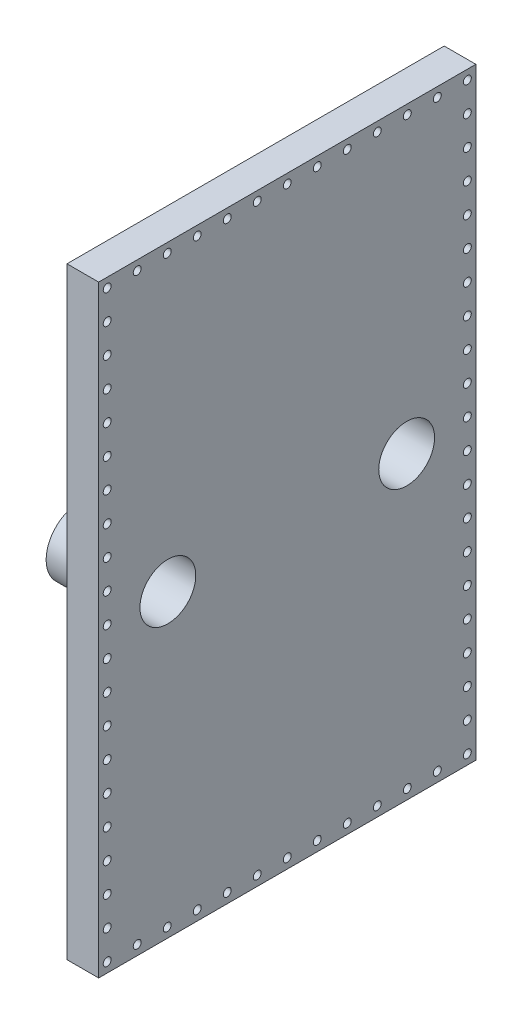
SolidWorks part; units mm, degrees
ref_plane "Alzado" through (0, 0, 0) normal (0, 0, 1) x (1, 0, 0)
ref_plane "Planta" through (0, 0, 0) normal (0, 1, 0) x (1, 0, 0)
ref_plane "Vista lateral" through (0, 0, 0) normal (1, 0, 0) x (0, 0, -1)
sketch "Croquis1" plane through (0, 0, 0) normal (0, 0, 1) x (1, 0, 0)
  line L0 (0, 0) -> (1191.5, 0)
  line L1 (1191.5, 0) -> (1191.5, 723)
  line L2 (0, 723) -> (1191.5, 723)
  line L3 (0, 0) -> (0, 723)
  line L6 (38, 38) -> (38, 685)
  line L11 (38, 38) -> (1153.5, 38)
  line L12 (1153.5, 38) -> (1153.5, 685)
  line L13 (38, 685) -> (1153.5, 685)
extrude "Saliente-Extruir1" add sketch "Croquis1" along normal blind 452.5
sketch "Croquis7" plane through (0, 0, 0) normal (-1, 0, 0) x (0, 0, 1)
  circle A0 centre (83, 360) radius 40
  circle A1 centre (369.5, 360) radius 40
  dimension "D1" = 83
  dimension "D5" = 80
  dimension "D6" = 80
  dimension "D2" = 360
  dimension "D3" = 83
  dimension "D4" = 360
extrude "Saliente-Extruir3" add sketch "Croquis7" along normal blind 68
sketch "Croquis8" plane through (-68, 0, 0) normal (-1, 0, 0) x (0, 0, 1)
  circle A0 centre (83, 360) radius 33.5
  circle A1 centre (369.5, 360) radius 33.5
  dimension "D1" = 67
  dimension "D2" = 67
extrude "Cortar-Extruir1" cut sketch "Croquis8" against normal blind 106
sketch "Croquis9" plane through (1191.5, 0, 0) normal (1, 0, 0) x (0, 0, -1)
  circle A0 centre (-264.5, 101.5) radius 19
  circle A1 centre (-182, 624.5) radius 14.35
  dimension "D5" = 38
  dimension "D6" = 28.7
  dimension "D1" = 188
  dimension "D2" = 101.5
  dimension "D3" = 82.5
  dimension "D4" = 98.5
extrude "Cortar-Extruir2" cut sketch "Croquis9" against normal blind 38
sketch "Croquis14" plane through (0, 0, 0) normal (-1, 0, 0) x (0, 0, 1)
  circle A0 centre (10.25, 711.75) radius 4.7625
  circle A1 centre (46.25, 711.75) radius 4.7625
  circle A2 centre (82.25, 711.75) radius 4.7625
  circle A3 centre (118.25, 711.75) radius 4.7625
  circle A4 centre (154.25, 711.75) radius 4.7625
  circle A5 centre (190.25, 711.75) radius 4.7625
  circle A6 centre (226.25, 711.75) radius 4.7625
  circle A7 centre (262.25, 711.75) radius 4.7625
  circle A8 centre (298.25, 711.75) radius 4.7625
  circle A9 centre (334.25, 711.75) radius 4.7625
  circle A10 centre (370.25, 711.75) radius 4.7625
  circle A11 centre (406.25, 711.75) radius 4.7625
  circle A12 centre (442.25, 711.75) radius 4.7625
  circle A13 centre (10.25, 676.75) radius 4.7625
  circle A14 centre (10.25, 641.75) radius 4.7625
  circle A15 centre (10.25, 606.75) radius 4.7625
  circle A16 centre (10.25, 571.75) radius 4.7625
  circle A17 centre (10.25, 536.75) radius 4.7625
  circle A18 centre (10.25, 501.75) radius 4.7625
  circle A19 centre (10.25, 466.75) radius 4.7625
  circle A20 centre (10.25, 431.75) radius 4.7625
  circle A21 centre (10.25, 396.75) radius 4.7625
  circle A22 centre (10.25, 361.75) radius 4.7625
  circle A23 centre (10.25, 326.75) radius 4.7625
  circle A24 centre (10.25, 291.75) radius 4.7625
  circle A25 centre (10.25, 256.75) radius 4.7625
  circle A26 centre (10.25, 221.75) radius 4.7625
  circle A27 centre (10.25, 186.75) radius 4.7625
  circle A28 centre (10.25, 151.75) radius 4.7625
  circle A29 centre (10.25, 116.75) radius 4.7625
  circle A30 centre (10.25, 81.75) radius 4.7625
  circle A31 centre (10.25, 46.75) radius 4.7625
  circle A32 centre (10.25, 11.75) radius 4.7625
  circle A33 centre (46.25, 11.75) radius 4.7625
  circle A34 centre (82.25, 11.75) radius 4.7625
  circle A35 centre (118.25, 11.75) radius 4.7625
  circle A36 centre (154.25, 11.75) radius 4.7625
  circle A37 centre (190.25, 11.75) radius 4.7625
  circle A38 centre (226.25, 11.75) radius 4.7625
  circle A39 centre (262.25, 11.75) radius 4.7625
  circle A40 centre (298.25, 11.75) radius 4.7625
  circle A41 centre (334.25, 11.75) radius 4.7625
  circle A42 centre (370.25, 11.75) radius 4.7625
  circle A43 centre (406.25, 11.75) radius 4.7625
  circle A44 centre (442.25, 11.75) radius 4.7625
  circle A45 centre (442.25, 46.75) radius 4.7625
  circle A46 centre (442.25, 81.75) radius 4.7625
  circle A47 centre (442.25, 116.75) radius 4.7625
  circle A48 centre (442.25, 151.75) radius 4.7625
  circle A49 centre (442.25, 186.75) radius 4.7625
  circle A50 centre (442.25, 221.75) radius 4.7625
  circle A51 centre (442.25, 256.75) radius 4.7625
  circle A52 centre (442.25, 291.75) radius 4.7625
  circle A53 centre (442.25, 326.75) radius 4.7625
  circle A54 centre (442.25, 361.75) radius 4.7625
  circle A55 centre (442.25, 396.75) radius 4.7625
  circle A56 centre (442.25, 431.75) radius 4.7625
  circle A57 centre (442.25, 466.75) radius 4.7625
  circle A58 centre (442.25, 501.75) radius 4.7625
  circle A59 centre (442.25, 536.75) radius 4.7625
  circle A60 centre (442.25, 571.75) radius 4.7625
  circle A61 centre (442.25, 606.75) radius 4.7625
  circle A62 centre (442.25, 641.75) radius 4.7625
  circle A63 centre (442.25, 676.75) radius 4.7625
  dimension "D1" = 9.525
  dimension "D2" = 10.25
  dimension "D3" = 11.25
  dimension "D5" = 21
  dimension "D6" = 13
  dimension "D7" = 35
  dimension "D4" = 13
  dimension "D8" = 20
sketch "Croquis15" plane through (0, 0, 452.5) normal (0, 0, 1) x (1, 0, 0)
  line L0 (38, 38) -> (76, 38)
  line L1 (38, 38) -> (1153.5, 38) construction
  line L2 (76, 38) -> (76, 685)
  line L3 (1153.5, 685) -> (38, 685) construction
  line L4 (76, 685) -> (38, 685)
  line L5 (38, 685) -> (38, 38)
  dimension "D1" = 38
extrude "Saliente-Extruir4" add sketch "Croquis15" against normal blind 40
sketch "Croquis16" plane through (0, 0, 0) normal (0, 0, -1) x (-1, 0, 0)
  line L0 (-38, 38) -> (-76, 38)
  line L1 (-76, 38) -> (-76, 685)
  line L2 (-76, 685) -> (-38, 685)
  line L3 (-38, 685) -> (-38, 38)
  dimension "D1" = 38
extrude "Saliente-Extruir5" add sketch "Croquis16" against normal blind 40
extrude "Cortar-Extruir3" cut sketch "Croquis14" against normal blind 70
sketch "Croquis17" plane through (0, 0, 452.5) normal (0, 0, 1) x (1, 0, 0)
  line L2 (1191.5, 723) -> (0, 723) construction
  line L5 (38, 723) -> (1191.5, 723)
  line L6 (38, 723) -> (38, 0)
  line L7 (38, 0) -> (1191.5, 0)
  line L8 (1191.5, 723) -> (1191.5, 0)
extrude "Cortar-Extruir4" cut sketch "Croquis17" against normal up to next
